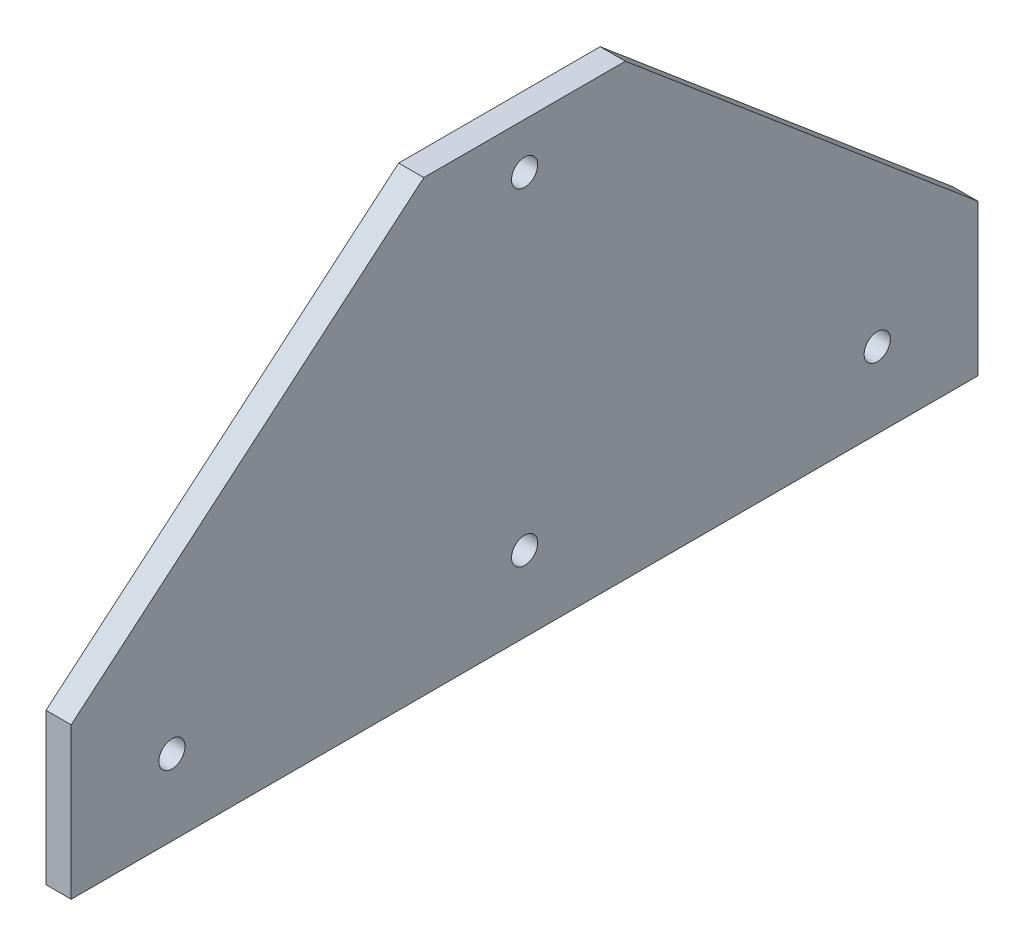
SolidWorks part; units mm, degrees
ref_plane "Front Plane" through (0, 0, 0) normal (0, 0, 1) x (1, 0, 0)
ref_plane "Top Plane" through (0, 0, 0) normal (0, 1, 0) x (1, 0, 0)
ref_plane "Right Plane" through (0, 0, 0) normal (1, 0, 0) x (0, 0, -1)
sketch "Sketch3" plane through (0, 0, 0) normal (1, 0, 0) x (0, 0, -1)
  line L0 (-77.6345, 34.8645) -> (150.9655, 34.8645)
  line L1 (150.9655, 34.8645) -> (150.9655, 72.9645)
  line L2 (-77.6345, 34.8645) -> (-77.6345, 72.9645)
  line L3 (-77.6345, 72.9645) -> (11.2655, 147.9832)
  line L4 (11.2655, 147.9832) -> (62.0655, 147.9832)
  line L5 (62.0655, 147.9832) -> (150.9655, 72.9645)
  line L6 (36.6655, 34.8645) -> (36.6655, 152.4652) construction
  dimension "D1" = 228.6
  dimension "D2" = 25.4
  dimension "D3" = 114.3
  dimension "D4" = 38.1
  dimension "D5" = 50.8
extrude "Boss-Extrude1" add sketch "Sketch3" along normal blind 6.35
sketch "Sketch4" plane through (0, 0, 0) normal (-1, 0, 0) x (0, 0, 1)
  line L0 (77.6345, 34.8645) -> (-150.9655, 34.8645) construction
  line L1 (-150.9655, 34.8645) -> (-150.9655, 72.9645) construction
  line L2 (77.6345, 72.9645) -> (77.6345, 34.8645) construction
  circle A0 centre (52.2345, 53.9145) radius 3.302
  circle A1 centre (-36.6655, 53.9145) radius 3.302
  circle A2 centre (-36.6655, 136.4645) radius 3.302
  circle A3 centre (-125.5655, 53.9145) radius 3.302
  point P12 (77.6345, 53.9145)
  dimension "D6" = 6.604
  dimension "D1" = 19.05
  dimension "D2" = 101.6
  dimension "D3" = 25.4
  dimension "D4" = 25.4
  dimension "D5" = 114.3
extrude "Cut-Extrude1" cut sketch "Sketch4" against normal through all
